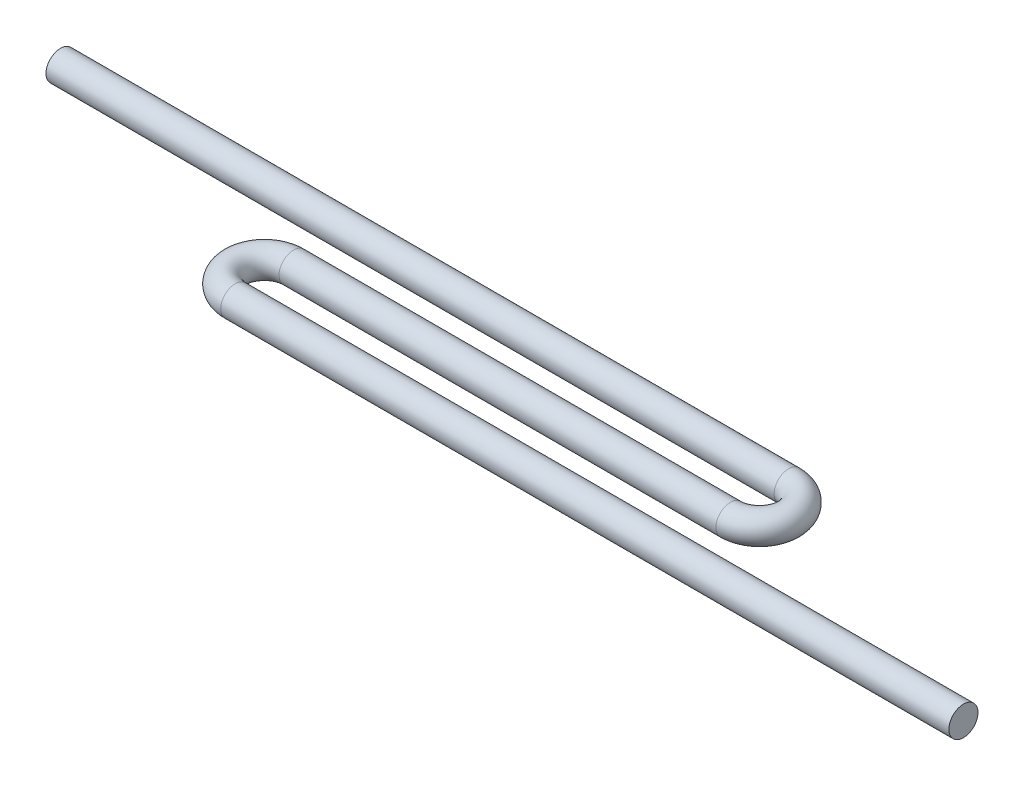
SolidWorks part; units mm, degrees
ref_plane "Front Plane" through (0, 0, 0) normal (0, 0, 1) x (1, 0, 0)
ref_plane "Top Plane" through (0, 0, 0) normal (0, 1, 0) x (1, 0, 0)
ref_plane "Right Plane" through (0, 0, 0) normal (1, 0, 0) x (0, 0, -1)
sketch "Sketch1" plane through (0, 0, 0) normal (0, 1, 0) x (1, 0, 0)
  line L0 (0, 0) -> (250, 0)
  line L1 (250, -20) -> (100, -20)
  line L2 (100, -40) -> (350, -40)
  arc A0 (250, 0) -> (250, -20) centre (250, -10) cw
  arc A1 (100, -40) -> (100, -20) centre (100, -30) cw
  dimension "D1" = 250
  dimension "D2" = 150
  dimension "D3" = 20
  dimension "D4" = 20
sketch "Sketch2" plane through (0, 0, 0) normal (1, 0, 0) x (0, 0, -1)
  circle A0 centre (0, 0) radius 5
  dimension "D1" = 10
sweep "Sweep1" add profiles "Sketch2" path "Sketch1"
shell "Shell1" thickness 1.5
